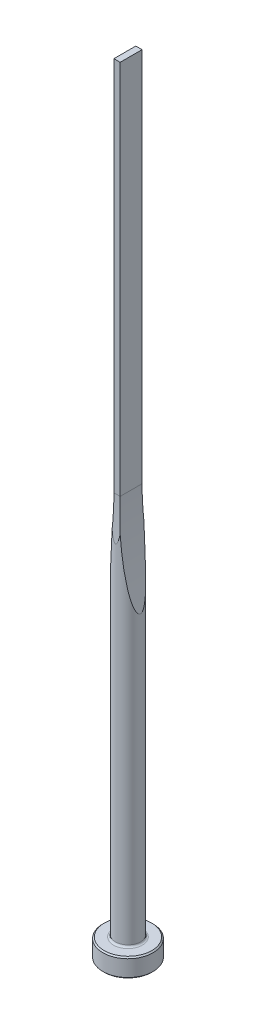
SolidWorks part; units mm, degrees
ref_plane "Front Plane" through (0, 0, 0) normal (0, 0, 1) x (1, 0, 0)
ref_plane "Top Plane" through (0, 0, 0) normal (0, 1, 0) x (1, 0, 0)
ref_plane "Right Plane" through (0, 0, 0) normal (1, 0, 0) x (0, 0, -1)
sketch "Sketch1" plane through (0, 0, 0) normal (0, 0, 1) x (1, 0, 0)
  line L0 (0, 0) -> (3.8, 0)
  line L1 (55, 0) -> (-55, 0) construction
  line L2 (4, 0.2) -> (4, 2.8)
  line L3 (3.8, 3) -> (2.3, 3)
  line L4 (2, 3.3) -> (2, 125)
  line L5 (0, 125) -> (2, 125)
  line L6 (4, 2.8) -> (3.8, 3)
  line L7 (3.8, 0) -> (4, 0.2)
  line L8 (0, 125) -> (0, 0)
  arc A0 (2, 3.3) -> (2.3, 3) centre (2.3, 3.3) ccw
  point P1 (4, 0)
  point P6 (4, 3)
  dimension "D4" = 0.3
  dimension "D1" = 2
  dimension "D2" = 4
  dimension "D3" = 3
  dimension "D5" = 125
revolve "Revolve1" add sketch "Sketch1" angle 360 about L8
sketch "Sketch2" plane through (0, 0, 0) normal (0, 0, 1) x (1, 0, 0)
  line L0 (0.5, 125) -> (0.5, 65)
  line L1 (2, 125) -> (-2, 125) construction
  line L2 (-0.5, 125) -> (-0.5, 65)
  line L3 (2, 125) -> (2, 48.6369)
  line L4 (-2, 125) -> (-2, 48.6369)
  line L5 (0, -4.4) -> (0, 4.4) construction
  line L6 (2, 125) -> (0.5, 125)
  line L8 (-0.5, 125) -> (-2, 125)
  arc A0 (0.5, 65) -> (2, 48.6369) centre (90.5, 65) ccw
  arc A1 (-0.5, 65) -> (-2, 48.6369) centre (-90.5, 65) cw
  dimension "D4" = 90
  dimension "D1" = 60
  dimension "D2" = 1
  dimension "D3" = 0.5
extrude "Cut-Extrude1" cut sketch "Sketch2" against normal mid plane 10
sketch "Sketch3" plane through (0, 0, 0) normal (1, 0, 0) x (0, 0, -1)
  line L0 (1.75, 125) -> (1.75, 65)
  line L1 (-1.9365, 125) -> (1.9365, 125) construction
  line L2 (-1.75, 125) -> (-1.75, 65)
  line L3 (2, 125) -> (2, 58.2965)
  line L4 (1.75, 125) -> (2, 125)
  line L5 (0, 4.4) -> (0, -4.4) construction
  line L6 (-2, 125) -> (-2, 58.2965)
  line L8 (-1.75, 125) -> (-2, 125)
  arc A0 (1.75, 65) -> (2, 58.2965) centre (91.75, 65) ccw
  arc A1 (-1.75, 65) -> (-2, 58.2965) centre (-91.75, 65) cw
  dimension "D2" = 90
  dimension "D1" = 60
  dimension "D3" = 3.5
  dimension "D4" = 1.75
extrude "Cut-Extrude2" cut sketch "Sketch3" against normal mid plane 10
